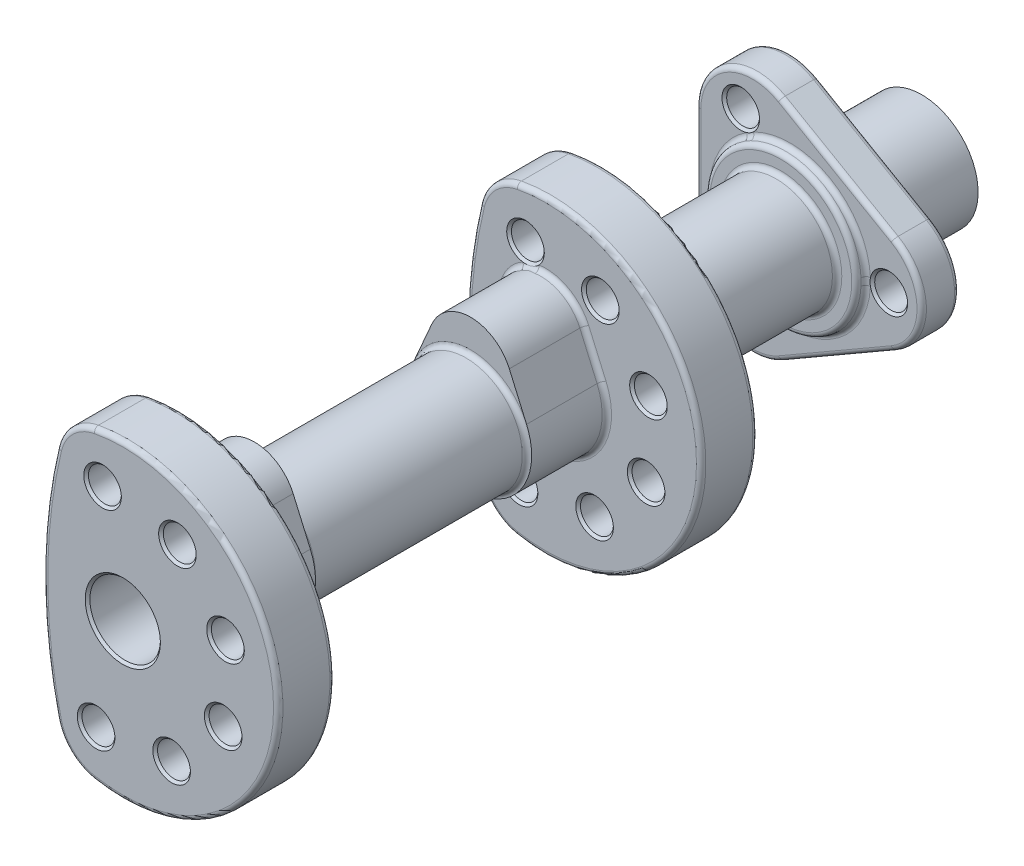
SolidWorks part; units mm, degrees
ref_plane "Front Plane" through (0, 0, 0) normal (0, 0, 1) x (1, 0, 0)
ref_plane "Top Plane" through (0, 0, 0) normal (0, 1, 0) x (1, 0, 0)
ref_plane "Right Plane" through (0, 0, 0) normal (1, 0, 0) x (0, 0, -1)
sketch "Sketch2" plane through (0, 0, 0) normal (0, 0, 1) x (1, 0, 0)
  line L0 (0, 0) -> (33.0814, 0) construction
  arc A0 (-6.1748, -32.5) -> (-6.1748, 32.5) centre (0, 0) ccw
  arc A2 (-14.0369, -24.9896) -> (-6.1748, -32.5) centre (-4.3082, -22.6757) ccw
  arc A3 (-14.0369, 24.9896) -> (-6.1748, 32.5) centre (-4.3082, 22.6757) cw
  arc A4 (-14.0369, 24.9896) -> (-14.0369, -24.9896) centre (91.0322, 0) ccw
  dimension "D1" = 66.1628
  dimension "D3" = 108
  dimension "D2" = 10
  dimension "D4" = 65
extrude "Boss-Extrude1" add sketch "Sketch2" along normal blind 12 separate body
sketch "Sketch5" plane through (0, 0, 0) normal (0, 0, -1) x (-1, 0, 0)
  circle A0 centre (4.3082, 22.6757) radius 3.5
  arc A1 (14.0369, 24.9896) -> (6.1748, 32.5) centre (4.3082, 22.6757) ccw construction
  dimension "D1" = 7
extrude "Cut-Extrude1" cut sketch "Sketch5" against normal up to next contours A0
pattern_circular "CirPattern1" count 6 every 41 about axis through (0, 0, 0) along (0, 0, 1) of "Cut-Extrude1"
sketch "Sketch3" plane through (0, 0, 0) normal (0, 0, 1) x (1, 0, 0)
  line L0 (-11.9147, 5.2) -> (-8.2486, 13.6)
  line L1 (8.2486, 13.6) -> (11.9147, 5.2)
  arc A1 (-11.9147, 5.2) -> (11.9147, 5.2) centre (0, 0) ccw
  arc A2 (-8.2486, 13.6) -> (8.2486, 13.6) centre (0, 10) cw
  dimension "D1" = 9
  dimension "D3" = 13
  dimension "D2" = 10
extrude "Boss-Extrude2" add sketch "Sketch3" against normal blind 16 contours A2 L1 A1 L0
sketch "Sketch4" plane through (0, 0, -16) normal (0, 0, -1) x (-1, 0, 0)
  circle A0 centre (0, 0) radius 12
  dimension "D1" = 24
extrude "Boss-Extrude3" add sketch "Sketch4" along normal blind 23
mirror "Mirror2" about plane through (0, 0, -39) normal (0, 0, -1)
sketch "Sketch6" plane through (0, 0, -90) normal (0, 0, 1) x (1, 0, 0)
  circle A0 centre (0, 0) radius 12 construction
  circle A1 centre (0, 0) radius 12
extrude "Boss-Extrude4" add sketch "Sketch6" against normal blind 40
combine bodies "Combine1" operation type add bodies to combine 104 109
sketch "Sketch7" plane through (0, 0, -130) normal (0, 0, -1) x (-1, 0, 0)
  line L1 (-22, -10.3923) -> (2, -24.2487)
  line L2 (20, -13.8564) -> (20, 13.8564)
  line L3 (2, 24.2487) -> (-22, 10.3923)
  circle A0 centre (0, 0) radius 20 construction
  arc A1 (2, -24.2487) -> (20, -13.8564) centre (8, -13.8564) ccw
  arc A2 (20, 13.8564) -> (2, 24.2487) centre (8, 13.8564) ccw
  arc A3 (-22, -10.3923) -> (-22, 10.3923) centre (-16, 0) cw
  dimension "D1" = 12
  dimension "D2" = 40
extrude "Boss-Extrude5" add sketch "Sketch7" along normal blind 8
sketch "Sketch8" plane through (0, 0, -130) normal (0, 0, 1) x (1, 0, 0)
  line L2 (-20, -13.8564) -> (-20, 13.8564) construction
  circle A0 centre (0, 0) radius 16.1081
  dimension "D1" = 3.8919
extrude "Boss-Extrude6" add sketch "Sketch8" along normal blind 2
hole_wizard "M8x1.0 Tapped Hole1" positions "Sketch10" profile "Sketch11" tap size "M8x1.0" standard "ANSI Metric"
sketch "Sketch10" plane through (0, 0, -138) normal (0, 0, 1) x (1, 0, 0)
  line L0 (0, 0) -> (28, 0) construction
  line L1 (0, 0) -> (-14, 24.2487) construction
  line L2 (0, 0) -> (-14, -24.2487) construction
  arc A0 (22, -10.3923) -> (22, 10.3923) centre (16, 0) ccw construction
  arc A1 (-2, 24.2487) -> (-20, 13.8564) centre (-8, 13.8564) ccw construction
  arc A2 (-20, -13.8564) -> (-2, -24.2487) centre (-8, -13.8564) ccw construction
  point P3 (21, 0)
  dimension "D1" = 7
sketch "Sketch11" plane through (21, 0, -138) normal (1, 0, 0) x (0, 1, 0)
  line L0 (0, 0) -> (0, 60)
  line L1 (0, 60) -> (3.5, 60)
  line L2 (3.5, 60) -> (3.5, 0)
  line L5 (3.5, 0) -> (0, 0)
  line L11 (0, -6.35) -> (0, 107.95) construction
  dimension "Thru Tap Drill Dia." = 7
  dimension "Thru Tap Drill Depth" = 60
sketch "Sketch13" plane through (0, 0, -138) normal (0, 0, -1) x (-1, 0, 0)
  circle A0 centre (0, 0) radius 12
  circle A1 centre (0, 0) radius 12 construction
extrude "Boss-Extrude7" add sketch "Sketch13" along normal blind 20
sketch "Sketch12" plane through (0, 0, -138) normal (0, 0, -1) x (-1, 0, 0)
  circle A0 centre (0, 0) radius 7.5
  dimension "D1" = 15
extrude "Cut-Extrude2" cut sketch "Sketch12" against normal through all both and the other way through all
pattern_circular "CirPattern2" count 3 over 360 about axis through (0, 0, 0) along (0, 0, 1) of "M8x1.0 Tapped Hole1"
chamfer "Chamfer1" distance 0.5 angle 45 31 edges at (-7.5, 0, 12) (17.5, 0, -130) (17.5, 0, -138) (-2.5065, -23.8511, -78) (-8.8507, -20.8928, -90) (13.7561, -19.6451, -78) (7.0272, -21.5745, -90) (21.3684, 10.8881, -78) (22.3426, 3.9562, -90) (23.2702, -5.8015, -78) (19.4577, -11.6722, -90) (8.9837, 22.2363, -78) (14.2666, 17.6439, -90) (-7.8082, 22.6757, -78) (-0.8082, 22.6757, -90) (-2.5065, -23.8511, 0) (-8.8507, -20.8928, 12) (7.0272, -21.5745, 12) (23.2702, -5.8015, 0) (19.4577, -11.6722, 12) (21.3684, 10.8881, 0) (22.3426, 3.9562, 12) (8.9837, 22.2363, 0) (14.2666, 17.6439, 12) (-7.8082, 22.6757, 0) (-0.8082, 22.6757, 12) (-7.5, 0, -158) (-14, -18.1865, -138) (-14, -18.1865, -130) (-14, 18.1865, -138) (-14, 18.1865, -130)
fillet "Fillet1" radius 1 43 edges at (33.0814, 0, 12) (-16.1081, 0, -130) (12, 0, -128) (16.1081, 0, -128) (-12, 0, -138) (-11.2157, 29.9067, 12) (-16.9678, 0, 12) (-10.0817, 9.4, 0) (0, 19, 0) (10.0817, 9.4, 0) (0, -13, 0) (-11.2157, 29.9067, 0) (33.0814, 0, 0) (-12, 0, -16) (-11.2157, -29.9067, 0) (-16.9678, 0, 0) (-12, 0, -62) (-16.9678, 0, -78) (-11.2157, -29.9067, -78) (33.0814, 0, -78) (-11.2157, 29.9067, -78) (-10.0817, 9.4, -78) (0, 19, -78) (10.0817, 9.4, -78) (-16.9678, 0, -90) (-11.2157, -29.9067, -90) (33.0814, 0, -90) (-11.2157, 29.9067, -90) (0, -13, -78) (-12, 0, -90) (-11.2157, -29.9067, 12) (-14, -24.2487, -130) (-20, 0, -130) (-14, 24.2487, -130) (10, 17.3205, -130) (28, 0, -130) (10, -17.3205, -130) (-14, -24.2487, -138) (-20, 0, -138) (-14, 24.2487, -138) (10, 17.3205, -138) (28, 0, -138) (10, -17.3205, -138)
